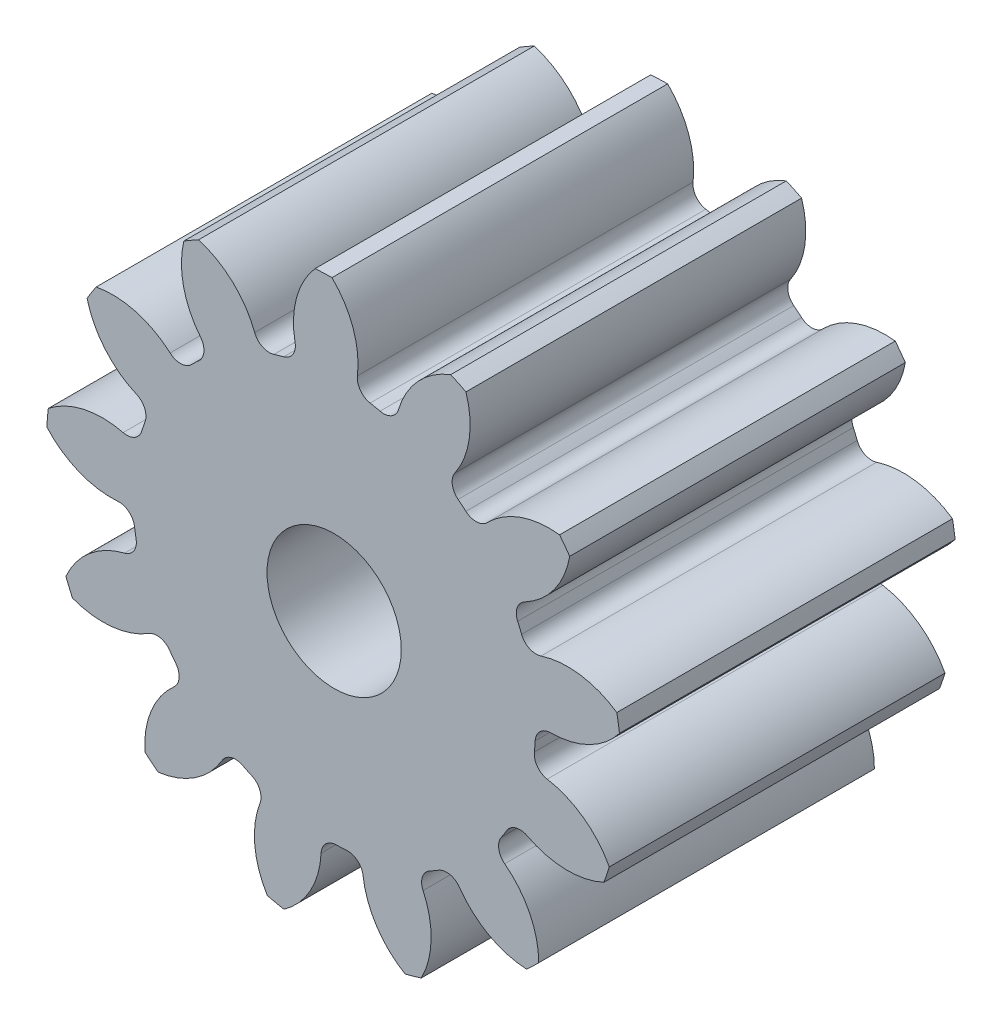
SolidWorks part; units mm, degrees
ref_plane "Front" through (0, 0, 0) normal (0, 0, 1) x (1, 0, 0)
ref_plane "Top" through (0, 0, 0) normal (0, 1, 0) x (1, 0, 0)
ref_plane "Right" through (0, 0, 0) normal (1, 0, 0) x (0, 0, -1)
sketch "Sketch3" plane through (0, 0, 0) normal (0, 0, 1) x (1, 0, 0)
  circle A0 centre (0, 0) radius 76.2
  dimension "od" = 152.4
extrude "gearBody" add sketch "Sketch3" along normal blind 88.9
sketch "Sketch2" plane through (0, 0, 0) normal (0, 0, 1) x (1, 0, 0)
  line L0 (0, 0) -> (57.3335, 23.7483) construction
  line L1 (73.3545, -23.1939) -> (0, 0) construction
  line L2 (0, 0) -> (36.3143, 0) construction
  line L3 (65.9947, 2.4466) -> (64.6565, -13.4471) construction
  line L5 (65.3256, -5.5002) -> (0, 0) construction
  line L7 (0, 0) -> (62.0573, 0) construction
  arc A0 (62.0449, 1.241) -> (60.9639, -11.598) centre (0, 0) ccw construction
  arc A1 (75.5741, 9.7463) -> (72.8805, -22.2458) centre (0, 0) ccw construction
  arc A2 (65.9947, 2.4466) -> (64.6565, -13.4471) centre (0, 0) ccw construction
  arc A3 (53.0227, -5.809) -> (53.2476, -3.1386) centre (0, 0) ccw
  arc A4 (73.3545, -23.1939) -> (56.4355, -10.3352) centre (52.5554, -33.0006) ccw
  arc A5 (73.3545, -23.1939) -> (76.2, 10.6018) centre (0, 0) ccw
  arc A6 (76.2, 10.6018) -> (57.3691, 0.7532) centre (57.3335, 23.7483) cw
  arc A7 (53.2476, -3.1386) -> (57.3691, 0.7532) centre (57.3755, -3.3819) cw
  arc A8 (56.4355, -10.3352) -> (53.0227, -5.809) centre (57.1333, -6.2594) cw
  point P6 (76.2, 10.6018)
  point P22 (73.3545, -23.1939)
  dimension "baseDia" = 124.1146
  dimension "od" = 152.4
  dimension "pd" = 132.08
  dimension "rd" = 106.68
  dimension "rFillet" = 4.1351
  dimension "pointX" = 76.2
  dimension "pointY" = 10.6018
  dimension "CTT" = 15.8937
  dimension "flankCenterAngle" = 22.5
extrude "toothCut" cut sketch "Sketch2" along normal through all
pattern_circular "CirPattern1" count 13 over 360 about axis through (0, 0, 0) along (0, 0, 1) of "toothCut"
sketch "hub1Dia" plane through (0, 0, 0) normal (0, 0, -1) x (-1, 0, 0)
  circle A0 centre (0, 0) radius 12.7
  dimension "hub1Dia" = 25.4
sketch "hub2Dia" plane through (0, 0, 88.9) normal (0, 0, 1) x (1, 0, 0)
  circle A0 centre (0, 0) radius 12.7
  dimension "hub2dia" = 25.4
sketch "boreDia" plane through (0, 0, 0) normal (0, 0, 1) x (1, 0, 0)
  circle A0 centre (0, 0) radius 17.78
  dimension "boreDia" = 35.56
extrude "bore" cut sketch "boreDia" against normal mid plane 25400
